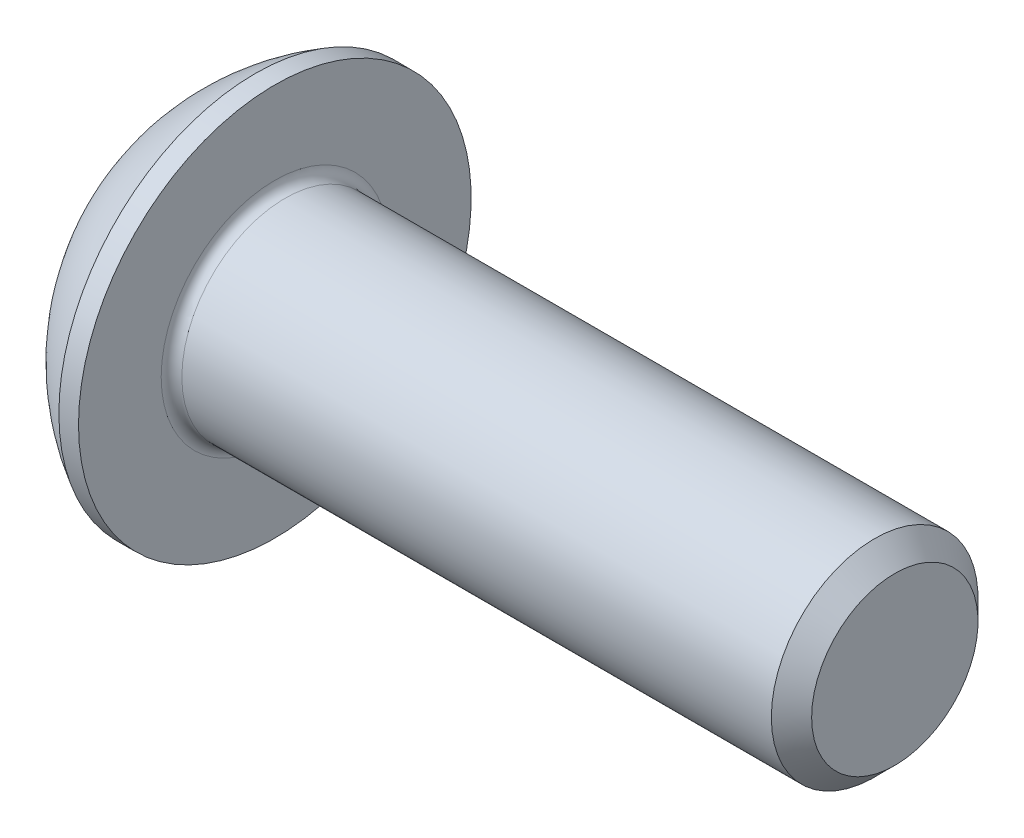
SolidWorks part; units mm, degrees
ref_plane "Plane1" through (0, 0, 0) normal (0, 0, 1) x (1, 0, 0)
ref_plane "Plane2" through (0, 0, 0) normal (0, 1, 0) x (1, 0, 0)
ref_plane "Plane3" through (0, 0, 0) normal (1, 0, 0) x (0, 0, -1)
sketch "BodySke" plane through (0, 0, 0) normal (0, 0, 1) x (1, 0, 0)
  line L0 (14.2, 0) -> (14.2, 1.61)
  line L1 (13.81, 2) -> (2.2, 2)
  line L2 (2.2, 2) -> (2.2, 3.8)
  line L3 (2.2, 3.8) -> (1.82, 3.8)
  line L4 (0, 0) -> (101.6, 0) construction
  line L5 (2.2, -3.8) -> (1.82, -3.8) construction
  line L6 (55.6768, -2) -> (2.2, -2) construction
  line L7 (14.2, 0) -> (0, 0)
  line L8 (0, 1.9) -> (0, -1.9) construction
  line L9 (0, 0) -> (0, 1.9)
  line L10 (14.2, 1.61) -> (13.81, 2)
  line L11 (14.2, -1.61) -> (13.81, -2) construction
  line L12 (2.9, 9.525) -> (2.9, -2) construction
  line L13 (2.2, 9.525) -> (2.2, -2) construction
  arc A1 (0, 1.9) -> (1.82, 3.8) centre (3.8853, 0) cw
  dimension "D1" = 3.8
  dimension "Diameter" = 4
  dimension "Length" = 12
  dimension "Head_dia" = 7.6
  dimension "Head_ht" = 2.2
  dimension "Head_side_ht" = 0.38
  dimension "Minor_dia" = 3.22
  dimension "Body_ch_ang" = 45
  dimension "Advance" = 0.7
  dimension "Thread_nom" = 12
revolve "BaseBody" add sketch "BodySke" angle 360 about L4
fillet "Fillet1" radius 0.2 1 edges at (2.2, 0, 2)
sketch "Sketch2" plane through (0, 0, 0) normal (0, 0, 1) x (1, 0, 0)
  line L0 (0, 1.25) -> (1.3, 1.25)
  line L1 (1.3, 1.25) -> (2.0217, 0)
  line L3 (2.0217, 0) -> (0, 0)
  line L4 (0, 0) -> (0, 1.25)
  line L5 (0, -1.25) -> (1.3, -1.25) construction
  line L6 (0, 0) -> (47.625, 0) construction
  dimension "D2" = 60
  dimension "PreBroach_depth" = 1.3
  dimension "PreBroach_dia" = 2.5
revolve "PreBroach" cut sketch "Sketch2" angle 360 about L6
sketch "Sketch3" plane through (0, 0, 0) normal (1, 0, 0) x (0, 0, -1)
  line L0 (-1.25, -0.7217) -> (-1.25, 0.7217)
  line L1 (-1.25, 0.7217) -> (0, 1.4434)
  line L2 (0, 1.4434) -> (1.25, 0.7217)
  line L3 (1.25, 0.7217) -> (1.25, -0.7217)
  line L4 (1.25, -0.7217) -> (0, -1.4434)
  line L5 (0, -1.4434) -> (-1.25, -0.7217)
  dimension "D1" = 1.25
  dimension "D2" = 1.25
  dimension "D3" = 2.5
  dimension "Hex_size" = 2.5
extrude "Hex" cut sketch "Sketch3" along normal blind 1.3
sketch "ThdSchSke" plane through (0, 0, 0) normal (0, 0, 1) x (1, 0, 0)
  line L0 (3.6, -1.61) -> (3.3269, -2)
  line L1 (3.6, -1.61) -> (3.8731, -2)
  line L2 (3.8731, -2) -> (3.8731, -2.5)
  line L3 (-3.175, 0) -> (5.1513, 0) construction
  line L5 (3.8731, -2.5) -> (3.3269, -2.5)
  line L6 (3.3269, -2.5) -> (3.3269, -2)
  dimension "Thread_minor" = 3.22
  dimension "Diameter" = 4
  dimension "Start" = 3.6
  dimension "SideAngle" = 55
  dimension "VeeAngle" = 70
  dimension "Overcut" = 5
revolve "ThreadSchematic" [suppressed] cut sketch "ThdSchSke" angle 360 about L3
pattern_linear "ThdSchPat" [suppressed]
equation "\"D1@BodySke\" = \"Head_dia@BodySke\" * .5"
equation "\"Thread_minor@ThreadCosmetic\" = \"Minor_dia@BodySke\""
equation "\"D1@Sketch3\" = \"Hex_size@Sketch3\" / 2"
equation "\"D2@Sketch3\" = \"D1@Sketch3\""
equation "\"D3@Sketch3\" = \"Hex_size@Sketch3\""
equation "\"Thread_length@ThreadCosmetic\" = ((sgn( (\"Length@BodySke\" - \"Advance@BodySke\" * 2.0) - \"Thread_nom@BodySke\" )-1)*( (\"Length@BodySke\" - \"Advance@BodySke\" * 2.0) - \"Thread_nom@BodySke\" ))/-2+ \"Thread_no"
equation "\"Thread_minor@ThdSchSke\" = \"Minor_dia@BodySke\""
equation "\"Diameter@ThdSchSke\" = \"Diameter@BodySke\""
equation "\"Overcut@ThdSchSke\" = \"Diameter@BodySke\" * 1.25"
equation "\"Start@ThdSchSke\" = \"Head_ht@BodySke\" + \"Length@BodySke\" - \"Thread_length@ThreadCosmetic\"  '---Non-countersunk---"
equation "\"Num_threads@ThdSchPat\" = int( \"Thread_length@ThreadCosmetic\" / \"Advance@BodySke\" + 0.999 )  + 1"
equation "\"Advance@ThdSchPat\" = \"Thread_length@ThreadCosmetic\" /  (\"Num_threads@ThdSchPat\" - 1) 'relax it"
equation "\"Num_threads@ThdSchPat\" = \"Num_threads@ThdSchPat\" - sgn( \"Num_threads@ThdSchPat\" - 1) '---chamfered tips only---"
